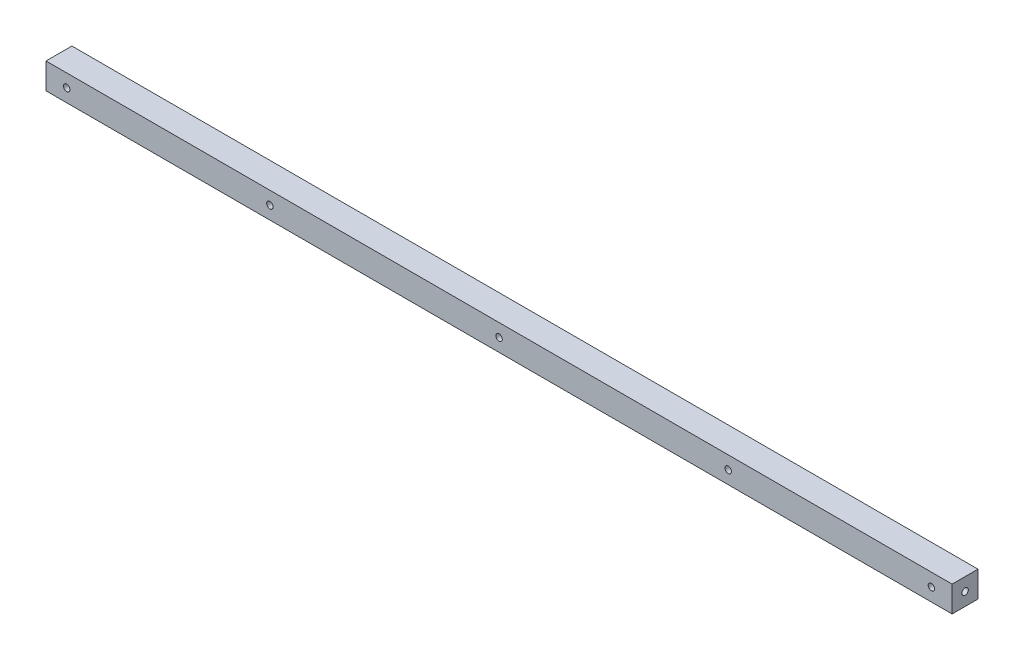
SolidWorks part; units mm, degrees
ref_plane "Plan de face" through (0, 0, 0) normal (0, 0, 1) x (1, 0, 0)
ref_plane "Plan de dessus" through (0, 0, 0) normal (0, 1, 0) x (1, 0, 0)
ref_plane "Plan de droite" through (0, 0, 0) normal (1, 0, 0) x (0, 0, -1)
sketch "Esquisse1" plane through (0, 0, 0) normal (1, 0, 0) x (0, 0, -1)
  line L0 (-10, -10) -> (10, 10) construction
  line L1 (-10, -10) -> (10, -10)
  line L2 (-10, -10) -> (-10, 10)
  line L3 (-10, 10) -> (10, 10)
  line L4 (10, -10) -> (10, 10)
  point P4 (0, 0)
  dimension "D1" = 20
  dimension "D2" = 20
extrude "Extrusion1" add sketch "Esquisse1" along normal mid plane 700
hole_wizard "Trou taraudé M6x1.01" positions "Esquisse3" profile "Esquisse2" tap size "M6x1.0" standard "ISO"
sketch "Esquisse3" plane through (0, 0, 10) normal (0, 0, 1) x (1, 0, 0)
  line L0 (-350, 10) -> (-350, -10) construction
  line L1 (350, -10) -> (-350, -10) construction
  point P0 (-334, 0)
  point P1 (-177, 0)
  point P3 (0, 0)
  point P5 (177, 0)
  point P7 (334, 0)
  dimension "D1" = 16
  dimension "D2" = 157
  dimension "D3" = 177
  dimension "D4" = 177
  dimension "D5" = 157
  dimension "D6" = 10
sketch "Esquisse2" plane through (-334, 0, 10) normal (1, 0, 0) x (0, -1, 0)
  line L0 (0, 0) -> (0, 20)
  line L1 (0, 20) -> (2.5, 20)
  line L2 (2.5, 20) -> (2.5, 0)
  line L5 (2.5, 0) -> (0, 0)
  line L11 (0, -6.35) -> (0, 107.95) construction
  dimension "Diamètre du trou pour taraudage jusqu'au prochain" = 5
  dimension "Profondeur du trou pour taraudage jusqu'au prochain" = 20
hole_wizard "Trou taraudé M6x1.02" positions "Esquisse5" profile "Esquisse4" tap size "M6x1.0" standard "ISO"
sketch "Esquisse5" plane through (-350, 0, 0) normal (-1, 0, 0) x (0, 0, 1)
  line L0 (-10, -10) -> (-10, 10) construction
  line L1 (-10, 10) -> (10, 10) construction
  point P0 (0, 0)
  dimension "D1" = 10
  dimension "D2" = 10
sketch "Esquisse4" plane through (-350, 0, 0) normal (0, 1, 0) x (0, 0, 1)
  line L0 (0, 0) -> (0, 21.5022)
  line L1 (0, 21.5022) -> (2.5, 20)
  line L2 (2.5, 20) -> (2.5, 0)
  line L5 (2.5, 0) -> (0, 0)
  line L10 (0, 21.5022) -> (-2.5, 20) construction
  line L11 (0, -6.35) -> (0, 107.95) construction
  dimension "Diamètre du trou pour taraudage" = 5
  dimension "Profondeur du trou pour taraudage" = 20
  dimension "Angle de pointe" = 118
hole_wizard "Trou taraudé M6x1.03" positions "Esquisse7" profile "Esquisse6" tap size "M6x1.0" standard "ISO"
sketch "Esquisse7" plane through (350, 0, 0) normal (1, 0, 0) x (0, 0, -1)
  line L0 (10, 10) -> (-10, 10) construction
  line L1 (10, -10) -> (10, 10) construction
  point P0 (0, 0)
  dimension "D1" = 10
  dimension "D2" = 10
sketch "Esquisse6" plane through (350, 0, 0) normal (0, 1, 0) x (0, 0, -1)
  line L0 (0, 0) -> (0, 21.5022)
  line L1 (0, 21.5022) -> (2.5, 20)
  line L2 (2.5, 20) -> (2.5, 0)
  line L5 (2.5, 0) -> (0, 0)
  line L10 (0, 21.5022) -> (-2.5, 20) construction
  line L11 (0, -6.35) -> (0, 107.95) construction
  dimension "Diamètre du trou pour taraudage" = 5
  dimension "Profondeur du trou pour taraudage" = 20
  dimension "Angle de pointe" = 118
